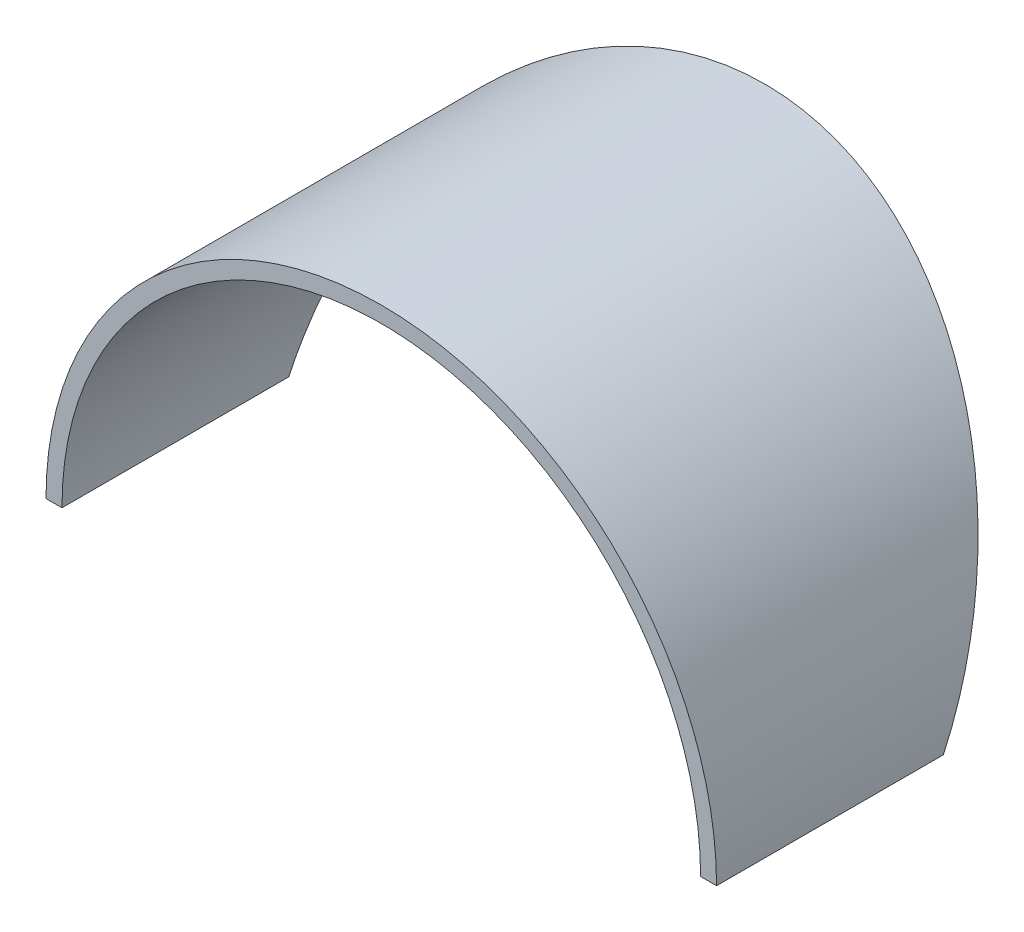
SolidWorks part; units mm, degrees
ref_plane "Front Plane" through (0, 0, 0) normal (0, 0, 1) x (1, 0, 0)
ref_plane "Top Plane" through (0, 0, 0) normal (0, 1, 0) x (1, 0, 0)
ref_plane "Right Plane" through (0, 0, 0) normal (1, 0, 0) x (0, 0, -1)
sketch "Sketch1" plane through (0, 0, 0) normal (0, 0, 1) x (1, 0, 0)
  line L0 (-55.372, 109.22) -> (-52.197, 109.22)
  line L1 (-182.372, 109.22) -> (-185.547, 109.22)
  line L2 (-55.372, 109.22) -> (-182.372, 109.22) construction
  arc A0 (-55.372, 109.22) -> (-182.372, 109.22) centre (-118.872, 109.22) ccw
  arc A1 (-55.372, 109.22) -> (-182.372, 109.22) centre (-118.872, 109.22) ccw construction
  arc A2 (-52.197, 109.22) -> (-185.547, 109.22) centre (-118.872, 109.22) ccw
  dimension "D1" = 63.5
  dimension "D2" = 3.175
extrude "Boss-Extrude1" add sketch "Sketch1" along normal blind 76.2
sketch "Sketch2" plane through (0, 0, 0) normal (1, 0, 0) x (0, 0, -1)
  line L0 (-31.0911, 109.22) -> (0, 175.895)
  line L1 (0, 175.895) -> (0, 109.22)
  line L2 (0, 109.22) -> (-31.0911, 109.22)
  line L3 (0, 109.22) -> (0, 175.895) construction
  line L4 (-76.2, 109.22) -> (0, 109.22) construction
  line L5 (0, 175.895) -> (-76.2, 175.895) construction
  dimension "D1" = 25
extrude "Cut-Extrude1" cut sketch "Sketch2" against normal through all
